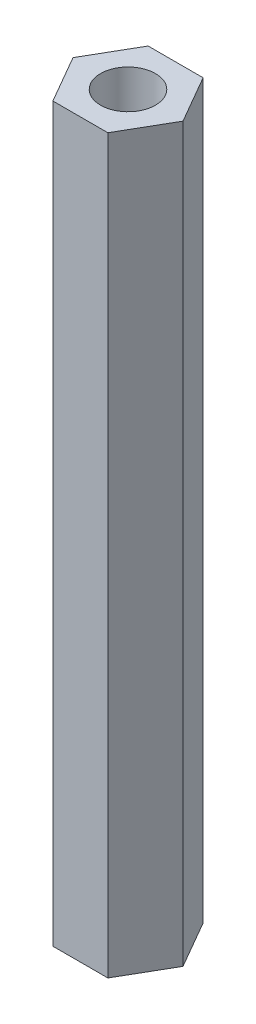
SolidWorks part; units mm, degrees
ref_plane "前视基准面" through (0, 0, 0) normal (0, 0, 1) x (1, 0, 0)
ref_plane "上视基准面" through (0, 0, 0) normal (0, 1, 0) x (1, 0, 0)
ref_plane "右视基准面" through (0, 0, 0) normal (1, 0, 0) x (0, 0, -1)
other "Configuration Table"
sketch "草图1" plane through (0, 0, 0) normal (0, 1, 0) x (1, 0, 0)
  line L1 (3.0049, 0) -> (1.5024, 2.6023)
  line L2 (1.5024, 2.6023) -> (-1.5024, 2.6023)
  line L3 (-1.5024, 2.6023) -> (-3.0049, 0)
  line L4 (-3.0049, 0) -> (-1.5024, -2.6023)
  line L5 (-1.5024, -2.6023) -> (1.5024, -2.6023)
  line L6 (1.5024, -2.6023) -> (3.0049, 0)
  circle A0 centre (0, 0) radius 1.5
  circle A2 centre (0, 0) radius 2.6023 construction
extrude "凸台-拉伸1" add sketch "草图1" along normal blind 40
